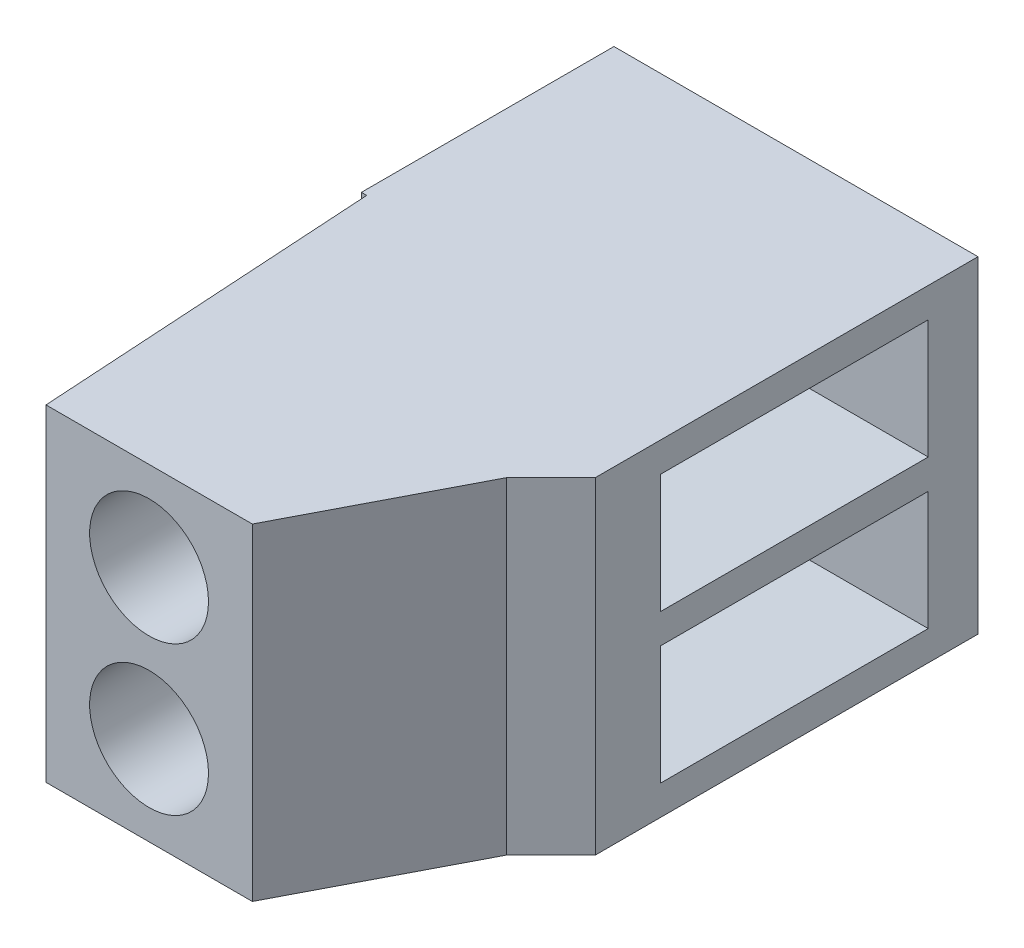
SolidWorks part; units mm, degrees
ref_plane "Front" through (0, 0, 0) normal (0, 0, 1) x (1, 0, 0)
ref_plane "Top" through (0, 0, 0) normal (0, 1, 0) x (1, 0, 0)
ref_plane "Right" through (0, 0, 0) normal (1, 0, 0) x (0, 0, -1)
sketch "Sketch1" plane through (0, 0, 0) normal (0, 0, 1) x (1, 0, 0)
  line L0 (-39.37, -39.37) -> (39.37, 39.37) construction
  line L1 (-39.37, 39.37) -> (39.37, 39.37)
  line L2 (-39.37, 39.37) -> (-39.37, -39.37)
  line L3 (-39.37, -39.37) -> (39.37, -39.37)
  line L4 (39.37, 39.37) -> (39.37, -39.37)
  dimension "D1" = 78.74
  dimension "D2" = 78.74
sketch "Sketch28" plane through (-163.3862, 51.5706, 0) normal (0, 0, 1) x (1, 0, 0)
  line L3 (165.9262, -54.3646) -> (163.3862, -54.3646)
  line L6 (163.3862, -54.3646) -> (163.3862, -48.7766)
  line L10 (163.3862, -48.7766) -> (165.9262, -48.7766)
  line L11 (165.9262, -54.3646) -> (165.9262, -48.7766)
  dimension "D2" = 5.588
  dimension "D3" = 2.54
extrude "Extrude1" add sketch "Sketch28" along normal blind 4.445
sketch "Sketch30" plane through (96.9558, 2.794, -5.9646) normal (0, 1, 0) x (-1, 0, 0)
  line L0 (137.1416, 10.2826) -> (103.1788, 10.2826) construction
  line L1 (96.9558, 5.9646) -> (103.1788, 5.9646)
  line L2 (96.9558, 5.9646) -> (96.9558, 12.5073)
  line L3 (99.2008, 16.1246) -> (102.7278, 16.1246)
  line L4 (103.1788, 5.9646) -> (103.1788, 10.2826)
  line L5 (96.9558, 10.4096) -> (96.9558, 5.9646) construction
  line L6 (99.7334, 17.1494) -> (97.7157, 13.2671) construction
  line L7 (130.3733, 13.2671) -> (97.7157, 13.2671) construction
  line L8 (97.7157, 13.2671) -> (96.9558, 12.5073)
  line L9 (97.7157, 13.2671) -> (99.2008, 16.1246)
  line L10 (103.1788, 10.2826) -> (103.088, 10.2826)
  line L11 (102.7278, 16.1246) -> (103.088, 10.2826)
  line L13 (94.4158, 5.9646) -> (96.9558, 5.9646) construction
  dimension "D1" = 6.223
  dimension "D2" = 3.527
  dimension "D3" = 4.318
  dimension "D4" = 2.8575
  dimension "D5" = 45
  dimension "D6" = 0.7599
  dimension "D7" = 0.0909
  dimension "D8" = 3.528
  dimension "D9" = 6.5426
  dimension "D10" = 10.16
extrude "Extrude2" add sketch "Sketch30" against normal up to surface (5.588 mm away)
sketch "Sketch32" plane through (-195.592, 50.3433, 10.16) normal (0, 0, 1) x (1, 0, 0)
  line L0 (193.3471, -53.1373) -> (193.3471, -47.5493) construction
  line L1 (191.5818, -49.0733) -> (191.5818, -51.6133) construction
  line L2 (191.5818, -50.3433) -> (195.592, -50.3433) construction
  circle A0 centre (191.5818, -49.0733) radius 1.016
  circle A1 centre (191.5818, -43.7393) radius 1.016 construction
  circle A2 centre (191.5818, -51.6133) radius 1.016
  dimension "D1" = 5.334
  dimension "D2" = 2.54
  dimension "D4" = 2.032
  dimension "D3" = 1.7653
extrude "Cut-Extrude7" cut sketch "Sketch32" against normal blind 2.54
sketch "Sketch37" plane through (0, 0, 4.445) normal (0, 0, 1) x (1, 0, 0)
  line L4 (2.54, 2.794) -> (0, 2.794)
  line L5 (0, 2.794) -> (0, -2.794)
  line L6 (0, -2.794) -> (2.54, -2.794)
  line L7 (2.54, -2.794) -> (2.54, 2.794)
  line L8 (2.54, 2.794) -> (0, 2.794)
  line L9 (0, 2.794) -> (0, -2.794)
  line L10 (0, -2.794) -> (2.54, -2.794)
  line L11 (2.54, -2.794) -> (2.54, 2.794)
  dimension "D1" = 0
extrude "Cut-Extrude10" cut sketch "Sketch37" against normal through all
sketch "Sketch36" plane through (0, 49.5125, 10.3271) normal (-1, 0, 0) x (0, 1, 0)
  line L0 (-48.2425, 3.2315) -> (-48.2425, 7.2612) construction
  line L1 (-52.3065, 10.3271) -> (-46.7185, 10.3271) construction
  line L2 (-50.7825, 4.9005) -> (-50.7825, 9.4762) construction
  line L3 (-51.7985, 4.9005) -> (-49.7665, 4.9005)
  line L4 (-49.2585, 4.9005) -> (-47.2265, 4.9005)
  line L5 (-49.2585, 9.4762) -> (-49.2585, 4.9005)
  line L6 (-51.7985, 9.4762) -> (-49.7665, 9.4762)
  line L7 (-51.7985, 4.9005) -> (-51.7985, 9.4762)
  line L8 (-49.2585, 9.4762) -> (-47.2265, 9.4762)
  line L10 (-48.2425, 9.4762) -> (-48.2425, 11.9146) construction
  line L12 (-49.2585, 9.4762) -> (-49.7665, 9.4762) construction
  line L13 (-47.2265, 9.4762) -> (-47.2265, 4.9005)
  line L14 (-49.5125, 9.4762) -> (-49.5125, 10.3271) construction
  line L22 (-49.7665, 9.4762) -> (-49.7665, 4.9005)
  dimension "D1" = 0.8509
  dimension "D2" = 2.54
  dimension "D3" = 4.5757
  dimension "D4" = 2.032
  dimension "D6" = 2.032
extrude "Cut-Extrude9" cut sketch "Sketch36" along normal blind 2.0002 draft 10
